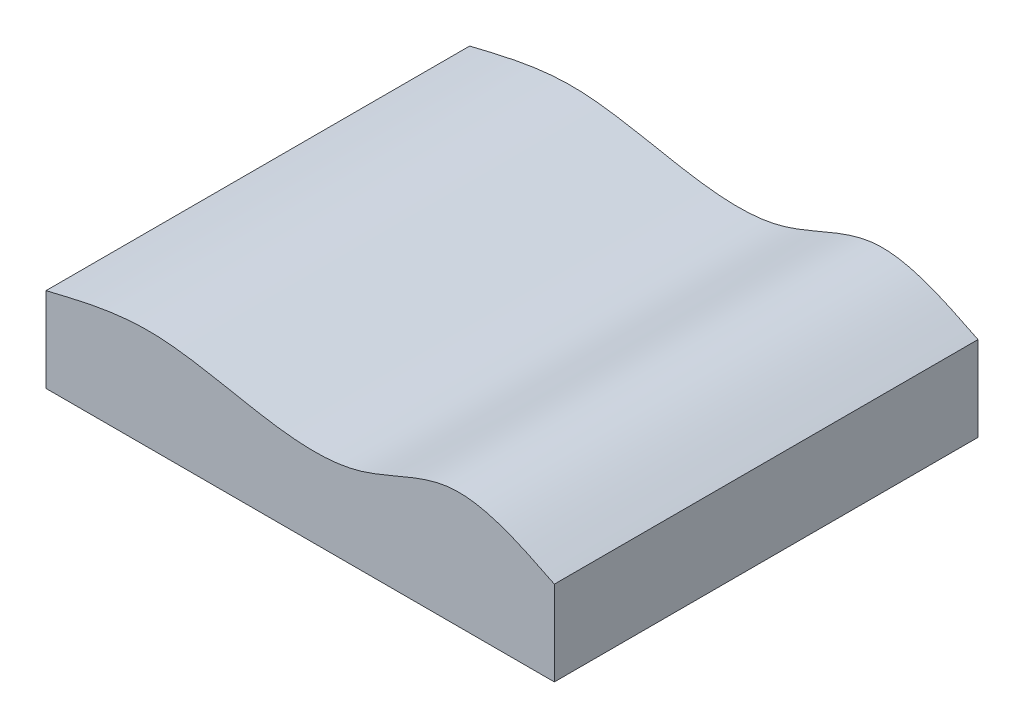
SolidWorks part; units mm, degrees
ref_plane "Plane1" through (0, 0, 0) normal (0, 0, 1) x (1, 0, 0)
ref_plane "Plane2" through (0, 0, 0) normal (0, 1, 0) x (1, 0, 0)
ref_plane "Plane3" through (0, 0, 0) normal (1, 0, 0) x (0, 0, -1)
sketch "Sketch1" plane through (0, 0, 0) normal (0, 0, 1) x (1, 0, 0)
  line L0 (0, 0) -> (152.4, 0)
  line L1 (152.4, 0) -> (152.4, 25.4)
  line L2 (0, 0) -> (0, 25.4)
  spline_without_curve S0
extrude "Base-Extrude" add sketch "Sketch1" along normal blind 127
ref_plane "Plane4" through (0, 50.8, 0) normal (0, 1, 0) x (-1, 0, 0)
ref_plane "Plane5" through (0, 50.8, 0) normal (0, 1, 0) x (-1, 0, 0)
sketch "Sketch2" plane through (0, 50.8, 0) normal (0, 1, 0) x (-1, 0, 0)
  line L3 (-107.3078, 35.6191) -> (-94.6078, 41.4806)
  line L9 (-94.6078, 29.4319) -> (-107.3078, 35.4563)
  line L10 (-107.3078, 35.4563) -> (-107.3078, 35.6191)
  line L12 (-99.9809, 31.9807) -> (-99.9809, 39.0007)
  line L14 (-94.6078, 44.9324) -> (-107.3078, 46.609)
  line L15 (-107.3078, 46.609) -> (-107.3078, 46.7718)
  line L16 (-107.3078, 46.7718) -> (-96.8873, 52.0151)
  line L17 (-96.8873, 52.0151) -> (-107.3078, 57.2457)
  line L18 (-107.3078, 57.2457) -> (-107.3078, 57.4111)
  line L19 (-107.3078, 57.4111) -> (-94.6078, 59.0978)
  line L34 (-107.3078, 77.8547) -> (-94.6078, 74.4304)
  line L35 (-94.6078, 74.4304) -> (-94.6078, 74.2676)
  line L36 (-94.6078, 74.2676) -> (-104.3211, 70.4464)
  line L37 (-104.3211, 70.4464) -> (-94.6078, 66.5794)
  line L38 (-94.6078, 66.5794) -> (-94.6078, 66.4166)
  line L39 (-94.6078, 66.4166) -> (-107.3078, 63.0381)
  line L40 (-102.5224, 97.1327) -> (-101.0011, 95.9929)
  line L45 (-94.6078, 95.9929) -> (-103.8886, 95.9929)
  line L48 (-99.0814, 103.8409) -> (-103.8886, 109.2038)
  line L51 (-100.2329, 105.1255) -> (-94.6078, 111.3306)
  line L56 (-94.6078, 103.8409) -> (-107.6335, 103.8409)
  spline_without_curve S4
  spline_without_curve S5
  spline_without_curve S6
  spline_without_curve S7
  spline_without_curve S8
  spline_without_curve S9
  spline_without_curve S10
  spline_without_curve S11
  spline_without_curve S12
  spline_without_curve S13
  spline_without_curve S14
  spline_without_curve S19
  spline_without_curve S20
  spline_without_curve S24
  spline_without_curve S29
  spline_without_curve S30
  spline_without_curve S31
  spline_without_curve S37
  spline_without_curve S38
  spline_without_curve S39
